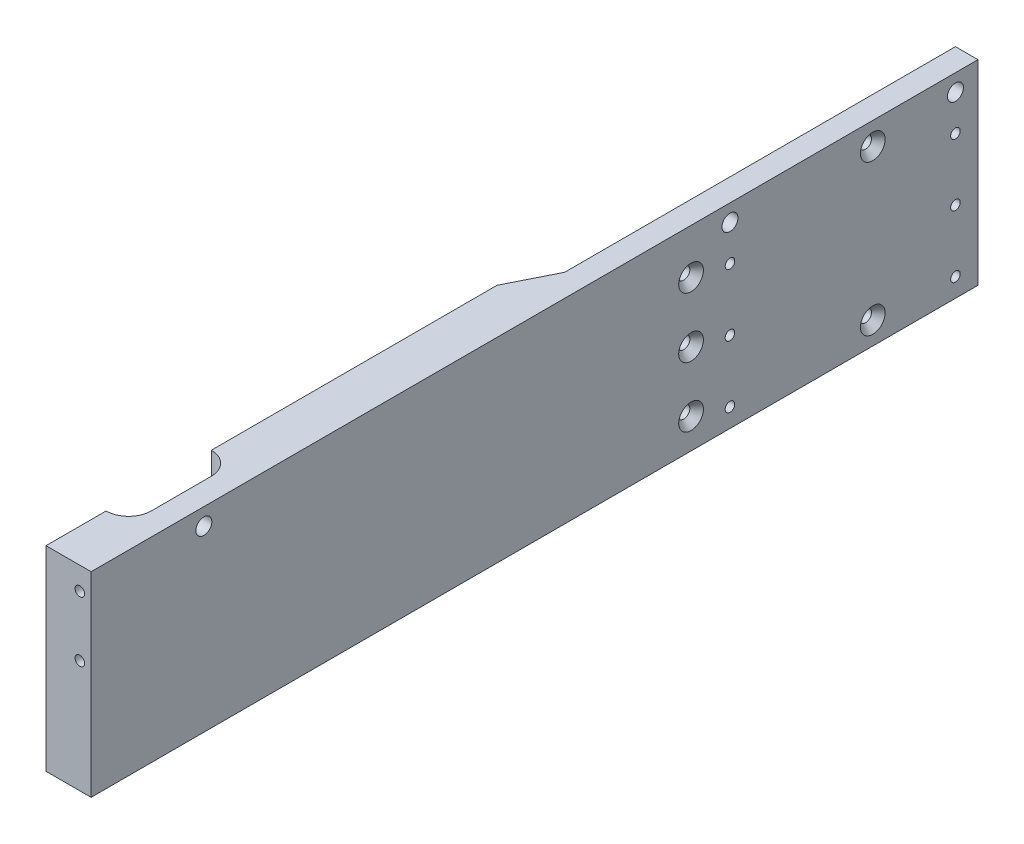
SolidWorks part; units mm, degrees
ref_plane "Front" through (0, 0, 0) normal (0, 0, 1) x (1, 0, 0)
ref_plane "Top" through (0, 0, 0) normal (0, 1, 0) x (1, 0, 0)
ref_plane "Right" through (0, 0, 0) normal (1, 0, 0) x (0, 0, -1)
ref_plane "Plane1" through (91.948, 0, 0) normal (1, 0, 0) x (0, 0, -1)
sketch "Sketch1" plane through (91.948, 0, 0) normal (1, 0, 0) x (0, 0, -1)
  line L1 (215.9, 48.4188) -> (400.05, 48.4188)
  line L2 (215.9, 48.4188) -> (215.9, -34.1376)
  line L3 (215.9, -34.1376) -> (400.05, -34.1376)
  line L4 (400.05, 48.4188) -> (400.05, -34.1376)
  dimension "D1" = 48.4188
  dimension "D2" = 34.1376
  dimension "D3" = 215.9
  dimension "D4" = 184.15
  dimension "D5" = 82.5564
extrude "Extrude1" add sketch "Sketch1" against normal blind 9.525
sketch "Sketch3" plane through (91.948, 0, 0) normal (-1, 0, 0) x (0, 0, 1)
  line L0 (-384.175, 0) -> (-327.025, 0) construction
  line L1 (-355.6, 7.9375) -> (-355.6, -7.9375) construction
  line L2 (-384.175, 7.9375) -> (-327.025, 7.9375)
  line L4 (-384.175, -15.875) -> (-327.025, -15.875) construction
  line L5 (-355.6, -7.9375) -> (-355.6, -23.8125) construction
  line L7 (-327.025, -23.8125) -> (-384.175, -23.8125)
  line L8 (-215.9, -34.1376) -> (-400.05, -34.1376) construction
  line L9 (-400.05, 48.4188) -> (-215.9, 48.4188) construction
  line L10 (-319.0875, -15.875) -> (-319.0875, 0)
  line L11 (-392.1125, -15.875) -> (-392.1125, 0)
  arc A0 (-327.025, 7.9375) -> (-319.0875, 0) centre (-327.025, 0) cw
  arc A1 (-384.175, 7.9375) -> (-392.1125, 0) centre (-384.175, 0) ccw
  arc A2 (-319.0875, -15.875) -> (-327.025, -23.8125) centre (-327.025, -15.875) cw
  arc A3 (-392.1125, -15.875) -> (-384.175, -23.8125) centre (-384.175, -15.875) ccw
  point P12 (-355.6, 0)
  point P19 (-355.6, -15.875)
  dimension "D1" = 327.025
  dimension "D3" = 73.025
  dimension "D2" = 7.9375
  dimension "D4" = 15.875
  dimension "Slot length" = 73.025
  dimension "D5" = 10.3251
  dimension "D6" = 40.4813
extrude "Slot" [suppressed] cut sketch "Sketch3" along normal through all
other "slot straight<1>" [suppressed]
hole_wizard "#10-32 Tapped Hole1" positions "Sketch6" profile "Sketch5" tap size "#10-32" standard "Ansi Inch"
sketch "Sketch6" plane through (91.948, 4.5482, -246.7671) normal (-1, 0, 0) x (0, 0, 1)
  point P0 (-48.5079, -4.5482)
  point P1 (-143.7579, -4.5482)
  point P7 (-48.5079, -30.7419)
  point P9 (-48.5079, 21.6456)
  point P11 (-143.7579, -30.7419)
  point P13 (-143.7579, 21.6456)
  dimension "D1" = 295.275
  dimension "D2" = 95.25
  dimension "D3" = 26.1937
  dimension "D4" = 26.1937
sketch "Sketch5" plane through (91.948, 0, -295.275) normal (0, 1, 0) x (0, 0, -1)
  line L0 (0, 0) -> (0, 9.525)
  line L1 (0, 9.525) -> (2.0193, 9.525)
  line L2 (2.0193, 9.525) -> (2.0193, 0)
  line L5 (2.0193, 0) -> (0, 0)
  line L11 (0, -6.35) -> (0, 107.95) construction
  dimension "Thru Tap Drill Dia." = 4.0386
  dimension "Thru Tap Drill Depth" = 9.525
sketch "Sketch7" plane through (0, 0, 0) normal (0, 1, 0) x (1, 0, 0)
  line L0 (82.423, 215.9) -> (82.423, 234.95)
  line L1 (72.898, 215.9) -> (82.423, 234.95)
  line L2 (82.423, 215.9) -> (72.898, 215.9)
  dimension "D1" = 9.525
  dimension "D2" = 19.05
extrude "Extrude2" add sketch "Sketch7" along normal up to surface and the other way up to surface
hole_wizard "1/4 Clearance Hole1" positions "Sketch13" profile "Sketch12" hole size "1/4" standard "Ansi Inch"
sketch "Sketch13" plane through (91.948, 0, 0) normal (1, 0, 0) x (0, 0, -1)
  point P0 (390.525, 41.275)
  point P1 (295.275, 41.275)
  dimension "D2" = 41.275
sketch "Sketch12" plane through (91.948, 41.275, -390.525) normal (0, 1, 0) x (0, 0, -1)
  line L0 (0, 0) -> (0, 19.05)
  line L1 (0, 19.05) -> (3.3782, 19.05)
  line L2 (3.3782, 19.05) -> (3.3782, 0)
  line L5 (3.3782, 0) -> (0, 0)
  line L11 (0, -6.35) -> (0, 107.95) construction
  dimension "Thru Hole Dia." = 6.7564
  dimension "Thru Hole Depth" = 19.05
sketch "Sketch14" plane through (0, 0, -215.9) normal (0, 0, 1) x (1, 0, 0)
  line L4 (91.948, -34.1376) -> (91.948, 48.4188)
  line L5 (91.948, 48.4188) -> (72.898, 48.4188)
  line L6 (72.898, 48.4188) -> (72.898, -34.1376)
  line L7 (72.898, -34.1376) -> (91.948, -34.1376)
  line L8 (91.948, -34.1376) -> (91.948, 48.4188)
  line L9 (91.948, 48.4188) -> (72.898, 48.4188)
  line L10 (72.898, 48.4188) -> (72.898, -34.1376)
  line L11 (72.898, -34.1376) -> (91.948, -34.1376)
  dimension "D1" = 0
extrude "Boss-Extrude1" add sketch "Sketch14" along normal blind 190.5
hole_wizard "#10-32 Tapped Hole2" positions "Sketch9" profile "Sketch8" tap size "#10-32" standard "Ansi Inch"
sketch "Sketch9" plane through (0, -34.1376, 0) normal (0, -1, 0) x (1, 0, 0)
  line L1 (91.948, -25.4) -> (91.948, -400.05) construction
  line L2 (72.898, -25.4) -> (91.948, -25.4) construction
  point P0 (87.1855, -66.675)
  point P6 (87.1855, -149.225)
  dimension "D1" = 41.275
  dimension "D2" = 4.7625
  dimension "D3" = 87.1855
  dimension "D4" = 66.675
  dimension "D5" = 82.55
sketch "Sketch8" plane through (87.1855, -34.1376, -66.675) normal (1, 0, 0) x (0, 0, -1)
  line L0 (0, 0) -> (0, 13.9133)
  line L1 (0, 13.9133) -> (2.0193, 12.7)
  line L2 (2.0193, 12.7) -> (2.0193, 0)
  line L5 (2.0193, 0) -> (0, 0)
  line L10 (0, 13.9133) -> (-2.0193, 12.7) construction
  line L11 (0, -6.35) -> (0, 107.95) construction
  dimension "Tap Drill Dia." = 4.0386
  dimension "Tap Drill Depth" = 12.7
  dimension "Drill Angle" = 118
hole_wizard "#10-32 Tapped Hole3" positions "Sketch11" profile "Sketch10" tap size "#10-32" standard "Ansi Inch"
sketch "Sketch11" plane through (-63.3587, 0.2186, -25.4) normal (0, 0, 1) x (1, 0, 0)
  line L0 (155.3067, -50.2186) -> (155.3067, 49.7814) construction
  line L3 (136.2567, -34.3562) -> (155.3067, -34.3562) construction
  point P0 (150.5442, 13.2688)
  point P7 (150.5442, 38.6688)
  point P9 (213.9703, -57.6313)
  dimension "D1" = 4.7625
  dimension "D2" = 47.625
  dimension "D3" = 25.4
sketch "Sketch10" plane through (87.1855, 13.4874, -25.4) normal (1, 0, 0) x (0, -1, 0)
  line L0 (0, 0) -> (0, 23.4383)
  line L1 (0, 23.4383) -> (2.0193, 22.225)
  line L2 (2.0193, 22.225) -> (2.0193, 0)
  line L5 (2.0193, 0) -> (0, 0)
  line L10 (0, 23.4383) -> (-2.0193, 22.225) construction
  line L11 (0, -6.35) -> (0, 107.95) construction
  dimension "Tap Drill Dia." = 4.0386
  dimension "Tap Drill Depth" = 22.225
  dimension "Drill Angle" = 118
sketch "Sketch15" plane through (0, -34.1376, 0) normal (0, -1, 0) x (1, 0, 0)
  line L0 (72.898, -25.4) -> (72.898, -215.9) construction
  line L1 (82.423, -85.725) -> (82.423, -60.325)
  line L2 (72.898, -50.8) -> (72.898, -95.25)
  line L3 (72.898, -25.4) -> (91.948, -25.4) construction
  arc A0 (72.898, -95.25) -> (82.423, -85.725) centre (72.898, -85.725) ccw
  arc A1 (82.423, -60.325) -> (72.898, -50.8) centre (72.898, -60.325) ccw
  point P1 (82.423, -73.025)
  dimension "D1" = 9.525
  dimension "D2" = 25.4
  dimension "D3" = 47.625
  dimension "D4" = 34.925
extrude "Cut-Extrude1" cut sketch "Sketch15" against normal through all
hole_wizard "1/4 Clearance Hole2" positions "Sketch17" profile "Sketch16" hole size "1/4" standard "Ansi Inch"
sketch "Sketch17" plane through (91.948, 0, 0) normal (1, 0, 0) x (0, 0, -1)
  line L0 (25.4, -34.1376) -> (25.4, 48.4188) construction
  point P0 (73.025, 41.275)
  dimension "D1" = 41.275
  dimension "D2" = 47.625
sketch "Sketch16" plane through (91.948, 41.275, -73.025) normal (0, 1, 0) x (0, 0, -1)
  line L0 (0, 0) -> (0, 33.7798)
  line L1 (0, 33.7798) -> (3.3782, 31.75)
  line L2 (3.3782, 31.75) -> (3.3782, 0)
  line L5 (3.3782, 0) -> (0, 0)
  line L10 (0, 33.7798) -> (-3.3782, 31.75) construction
  line L11 (0, -6.35) -> (0, 107.95) construction
  dimension "Hole Dia." = 6.7564
  dimension "Hole Depth" = 31.75
  dimension "Drill Angle" = 118
sketch "Sketch18" plane through (91.948, 0, 0) normal (1, 0, 0) x (0, 0, -1)
  line L1 (25.4, -34.1376) -> (25.4, 48.4188) construction
  line L2 (25.4, -34.1376) -> (400.05, -34.1376) construction
  circle A0 centre (369.8875, -37.3126) radius 12.7
  dimension "D1" = 12.7
  dimension "D3" = 3.175
  dimension "D2" = 344.4875
extrude "Cut-Extrude2" [suppressed] cut sketch "Sketch18" against normal up to next
hole_wizard "#9 (0.196) Diameter Hole1" positions "Sketch20" profile "Sketch19" hole size "#9" standard "Ansi Inch"
sketch "Sketch20" plane through (91.948, 0, 0) normal (1, 0, 0) x (0, 0, -1)
  line L0 (25.4, -34.1376) -> (357.5908, -34.1376) construction
  line L1 (25.4, -34.1376) -> (25.4, 48.4188) construction
  point P0 (277.5661, -21.4376)
  point P1 (277.5661, 3.9624)
  dimension "D1" = 25.4
  dimension "D2" = 12.7
  dimension "D3" = 252.1661
sketch "Sketch19" plane through (91.948, -21.4376, -277.5661) normal (0, 1, 0) x (0, 0, -1)
  line L0 (0, 0) -> (0, 19.05)
  line L1 (0, 19.05) -> (2.4892, 19.05)
  line L2 (2.4892, 19.05) -> (2.4892, 0)
  line L5 (2.4892, 0) -> (0, 0)
  line L11 (0, -6.35) -> (0, 107.95) construction
  dimension "Thru Hole Dia." = 4.9784
  dimension "Thru Hole Depth" = 19.05
hole_wizard "CSK for #10 Flat Head Socket Cap Screw1" positions "Sketch22" profile "Sketch21" countersink size "#10" standard "Ansi Inch"
sketch "Sketch22" plane through (91.948, 0, 0) normal (1, 0, 0) x (0, 0, -1)
  line L0 (25.4, -34.1376) -> (25.4, 48.4188) construction
  line L1 (400.05, 48.4188) -> (25.4, 48.4188) construction
  line L2 (25.4, -34.1376) -> (400.05, -34.1376) construction
  point P0 (355.6, 38.8938)
  point P5 (355.6, -24.6126)
  point P7 (362.9575, 76.4452)
  point P12 (278.8412, -21.4376)
  point P14 (278.8412, 3.9624)
  point P15 (278.8412, 29.3624)
  dimension "D1" = 330.2
  dimension "D2" = 9.525
  dimension "D3" = 9.525
  dimension "D4" = 12.7
  dimension "D5" = 25.4
  dimension "D6" = 253.4412
  dimension "D7" = 25.4
sketch "Sketch21" plane through (91.948, 38.8938, -355.6) normal (0, 1, 0) x (0, 0, -1)
  line L0 (0, 0) -> (0, 19.05)
  line L1 (0, 19.05) -> (2.5527, 19.05)
  line L2 (2.5527, 19.05) -> (2.5527, 3.068)
  line L3 (2.5527, 3.068) -> (5.2197, 0)
  line L5 (5.2197, 0) -> (0, 0)
  line L6 (-2.5527, 3.068) -> (-5.2197, 0) construction
  line L11 (0, -6.35) -> (0, 107.95) construction
  dimension "Thru Hole Dia." = 5.1054
  dimension "Thru Hole Depth" = 19.05
  dimension "Near C'Sink Dia." = 10.4394
  dimension "Near C'Sink Angle" = 82
sketch "Sketch24" plane through (91.948, 0, 0) normal (1, 0, 0) x (0, 0, -1)
  line L0 (25.4, -34.1376) -> (400.05, -34.1376) construction
  line L1 (285.75, -34.1376) -> (260.35, -34.1376)
  line L2 (285.75, -34.1376) -> (285.75, 16.6624)
  line L3 (285.75, 16.6624) -> (260.35, 16.6624)
  line L4 (260.35, -34.1376) -> (260.35, 16.6624)
  line L5 (400.05, -34.1376) -> (400.05, 48.4188) construction
  dimension "D1" = 114.3
  dimension "D2" = 50.8
  dimension "D3" = 25.4
extrude "Cut-Extrude3" [suppressed] cut sketch "Sketch24" against normal through all
equation "\"Buoyancy\"=\"SW-Volume\"*(\"SW-Density\"-.037062)"
